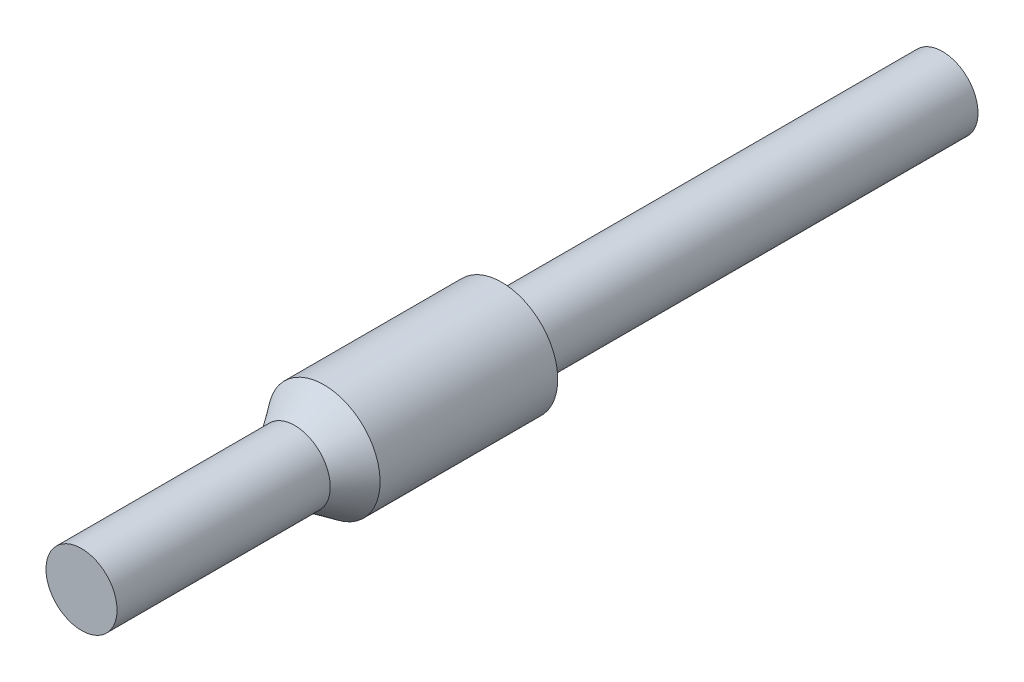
SolidWorks part; units mm, degrees
ref_plane "Alzado" through (0, 0, 0) normal (0, 0, 1) x (1, 0, 0)
ref_plane "Planta" through (0, 0, 0) normal (0, 1, 0) x (1, 0, 0)
ref_plane "Vista lateral" through (0, 0, 0) normal (1, 0, 0) x (0, 0, -1)
sketch "Croquis1" plane through (0, 0, 0) normal (1, 0, 0) x (0, 0, -1)
  line L0 (-142.007, 0) -> (100.291, 0) construction
  line L1 (-142.007, 0) -> (-142.007, 10)
  line L2 (-142.007, 10) -> (-82.007, 10)
  line L3 (-82.007, 10) -> (-73.7549, 15.7782)
  line L4 (-73.7549, 15.7782) -> (-23.7549, 15.7782)
  line L5 (-23.7549, 15.7782) -> (-19.709, 10)
  line L6 (-19.709, 10) -> (100.291, 10)
  line L7 (100.291, 10) -> (100.291, 0)
  line L8 (-142.007, 0) -> (100.291, 0)
  dimension "D1" = 10
  dimension "D2" = 10
  dimension "D3" = 50
  dimension "D4" = 60
  dimension "D5" = 120
  dimension "D6" = 145
revolve "Revolución1" add sketch "Croquis1" angle 360 about L0
